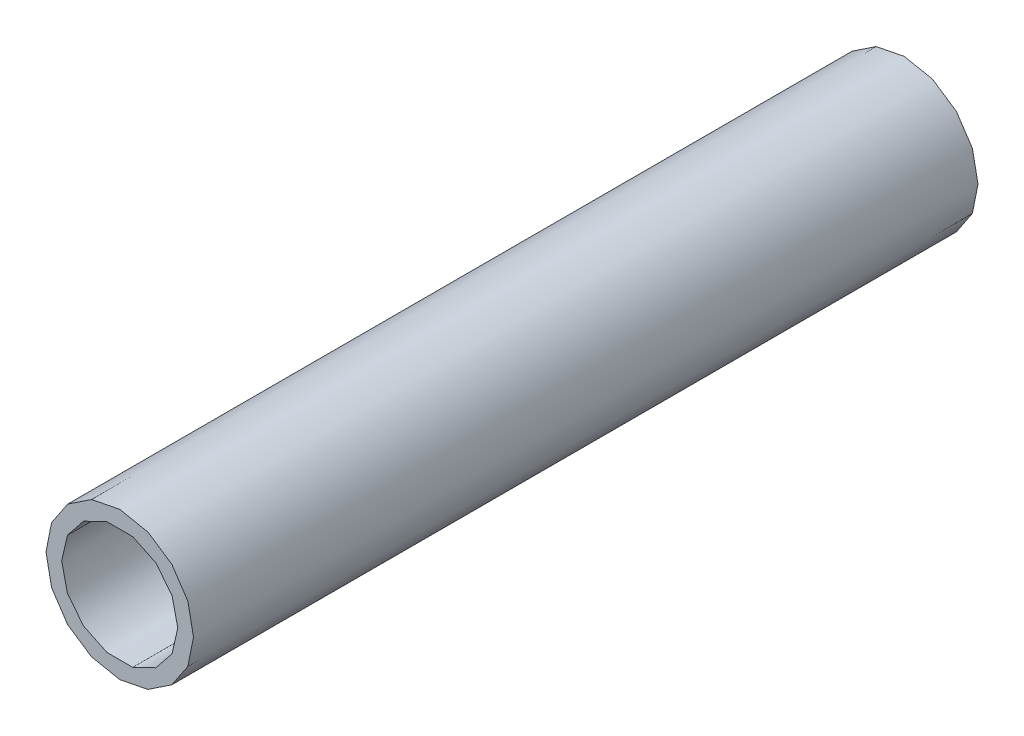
SolidWorks part; units mm, degrees
ref_plane "Front" through (0, 0, 0) normal (0, 0, 1) x (1, 0, 0)
ref_plane "Top" through (0, 0, 0) normal (0, 1, 0) x (1, 0, 0)
ref_plane "Side" through (0, 0, 0) normal (1, 0, 0) x (0, 0, -1)
other "Configuration Table"
sketch "FilterSketch" plane through (0, 0, 0) normal (0, 0, 1) x (1, 0, 0)
  circle A0 centre (0, 0) radius 12.7 construction
  dimension "NominalDiameter" = 25.4
sketch3d "3D草图2"
  line L0 (-2.5262, -0.5396, 10) -> (-2.5262, -0.5396, 19.3476) construction
  line L1 (-789.6448, 1044.6729, 316.7719) -> (-816.576, 1017.7417, 316.7719) construction
  line L2 (-2.5262, -0.5396, 0) -> (-2.5262, -0.5396, 19.3476)
  line L3 (-782.9964, 1051.3213, 316.7719) -> (-816.576, 1017.7417, 316.7719)
  spline S0 degree 3 poles (-700.9573, 595.2631, -377.0936) (1547.7742, -1297.4319, 347.705) (-2597.6316, 2043.2046, 358.8608) (139.2739, 725.3433, 289.2604) knots -0.427993 -0.427993 -0.427993 -0.427993 1.421077 1.421077 1.421077 1.421077 only from (-2.5262, -0.5396, 19.3476) to (-816.576, 1017.7417, 316.7719) construction
  spline S1 degree 3 poles (-2.5262, -0.5396, 19.3476) (-2.5262, -0.5396, 250.9996) (-973.8807, 860.437, 316.7719) (-816.576, 1017.7417, 316.7719) knots 0 0 0 0 1 1 1 1
ref_plane "基准面2" through (-2.5262, -0.5396, 0) normal (0, 0, 1) x (1, 0, 0)
sketch "管道草图" plane through (-2.5262, -0.5396, 0) normal (0, 0, 1) x (1, 0, 0)
  circle A0 centre (0, 0) radius 12.7
  circle A1 centre (0, 0) radius 12.192 construction
  dimension "外径" = 25.4
  dimension "内径" = 24.384
sweep "扫描-薄件2" add profiles "管道草图" path "3D草图2" parameters "D1"=0.508
